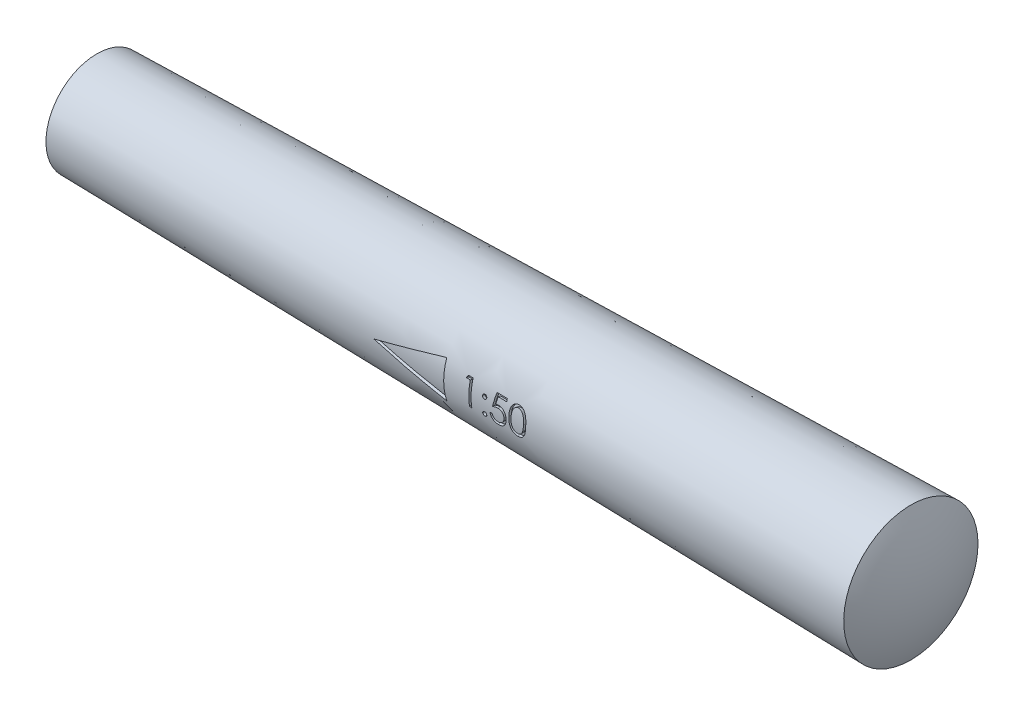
SolidWorks part; units mm, degrees
ref_plane "Front Plane" through (0, 0, 0) normal (0, 0, 1) x (1, 0, 0)
ref_plane "Top Plane" through (0, 0, 0) normal (0, 1, 0) x (1, 0, 0)
ref_plane "Right Plane" through (0, 0, 0) normal (1, 0, 0) x (0, 0, -1)
sketch "Sketch1" plane through (0, 0, 0) normal (1, 0, 0) x (0, 0, -1)
  circle A0 centre (0, 0) radius 2
  dimension "D1" = 4
extrude "Extrude1" add sketch "Sketch1" along normal mid plane 32
draft "Draft1" type of draft neutral plane draft angle 1.146 faces to draft 1 parameters "D1"=1.146
sketch "Sketch2" plane through (0, 0, 0) normal (0, 0, 1) x (1, 0, 0)
  line L0 (-16, 0) -> (-16, 2)
  line L1 (-16, 2) -> (-16, -2) construction
  line L2 (-16, 0) -> (-16.6, 0)
  line L3 (-16.6, 0) -> (-16.6, -2.32) construction
  line L4 (16, 0) -> (16, 2.64)
  line L5 (16, -2.64) -> (16, 2.64) construction
  line L6 (16, 0) -> (16.6, 0)
  line L7 (16.6, 0) -> (16.6, -2.32) construction
  line L8 (-16, -2) -> (16, -2.64) construction
  arc A0 (-16.6, 0) -> (-16, 2) centre (-12.9667, 0) cw
  arc A1 (16.6, 0) -> (16, 2.64) centre (10.4919, 0) ccw
  point P14 (0, -2.32)
revolve "Revolve1" add sketch "Sketch2" angle 360 about L2
sketch "Sketch5" plane through (0, 0, 0) normal (0, 0, 1) x (1, 0, 0)
  line L0 (0, 2.32) -> (0, -2.32) construction
  line L1 (16, 2.64) -> (-16, 2) construction
  line L2 (-16, -2) -> (16, -2.64) construction
ref_plane "Plane2" through (0, 0, 0) normal (-0.02, 0, 0.9998) x (0.9998, 0, 0.02)
sketch "Sketch6" plane through (0, 0, 0) normal (-0.02, 0, 0.9998) x (0.9998, 0, 0.02)
  line L0 (0, 0) -> (0, 0.75)
  line L1 (0, 2.32) -> (0, -2.32) construction
  line L2 (0, 0.75) -> (-2.799, 0)
  line L3 (-2.799, 0) -> (0, -0.75)
  line L4 (0, -0.75) -> (0, 0)
  line L5 (0, -0.375) -> (4, -0.375) construction
  text T0 "1:50" font "Century Gothic" height 1
  dimension "D1" = 1.5
  dimension "D2" = 30
  dimension "D3" = 4
wrap "Wrap2" sketch "Sketch6" wrap type deboss source sketch "Sketch6" thickness 0.1 parameters "D1"=0.1
equation "\"D2@Sketch2\" = \"D1@Sketch2\""
